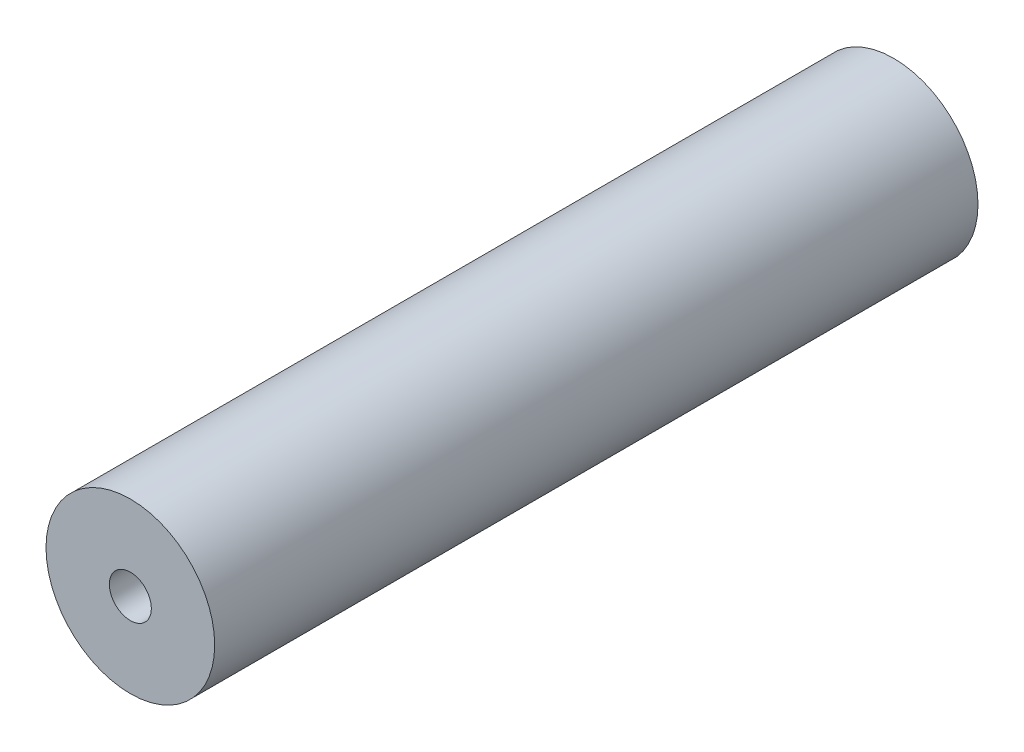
SolidWorks part; units mm, degrees
ref_plane "Front Plane" through (0, 0, 0) normal (0, 0, 1) x (1, 0, 0)
ref_plane "Top Plane" through (0, 0, 0) normal (0, 1, 0) x (1, 0, 0)
ref_plane "Right Plane" through (0, 0, 0) normal (1, 0, 0) x (0, 0, -1)
sketch "Sketch1" plane through (0, 0, 0) normal (0, 0, 1) x (1, 0, 0)
  line L10 (220.6788, 94.2) -> (151.3397, -25.8987)
  line L11 (150, -30.8987) -> (150, -60)
  line L12 (150, -60) -> (154.7454, -60)
  line L13 (154.7454, -60) -> (235.1125, 79.2)
  line L14 (226.4523, 94.2) -> (220.6788, 94.2)
  circle A0 centre (226.4523, 84.2) radius 2.4892
  arc A2 (151.3397, -25.8987) -> (150, -30.8987) centre (160, -30.8987) ccw
  circle A3 centre (226.4523, 84.2) radius 10
  arc A11 (235.1125, 79.2) -> (226.4523, 94.2) centre (226.4523, 84.2) ccw
  dimension "D2" = 10
  dimension "D3" = 150
  dimension "D1" = 4.9784
  dimension "D4" = 151.3397
  dimension "D5" = 154.7454
  dimension "D6" = 220.6788
  dimension "D7" = 79.2
extrude "Boss-Extrude1" add sketch "Sketch1" along normal blind 90.5 contours A3 A0 | A11 A3
